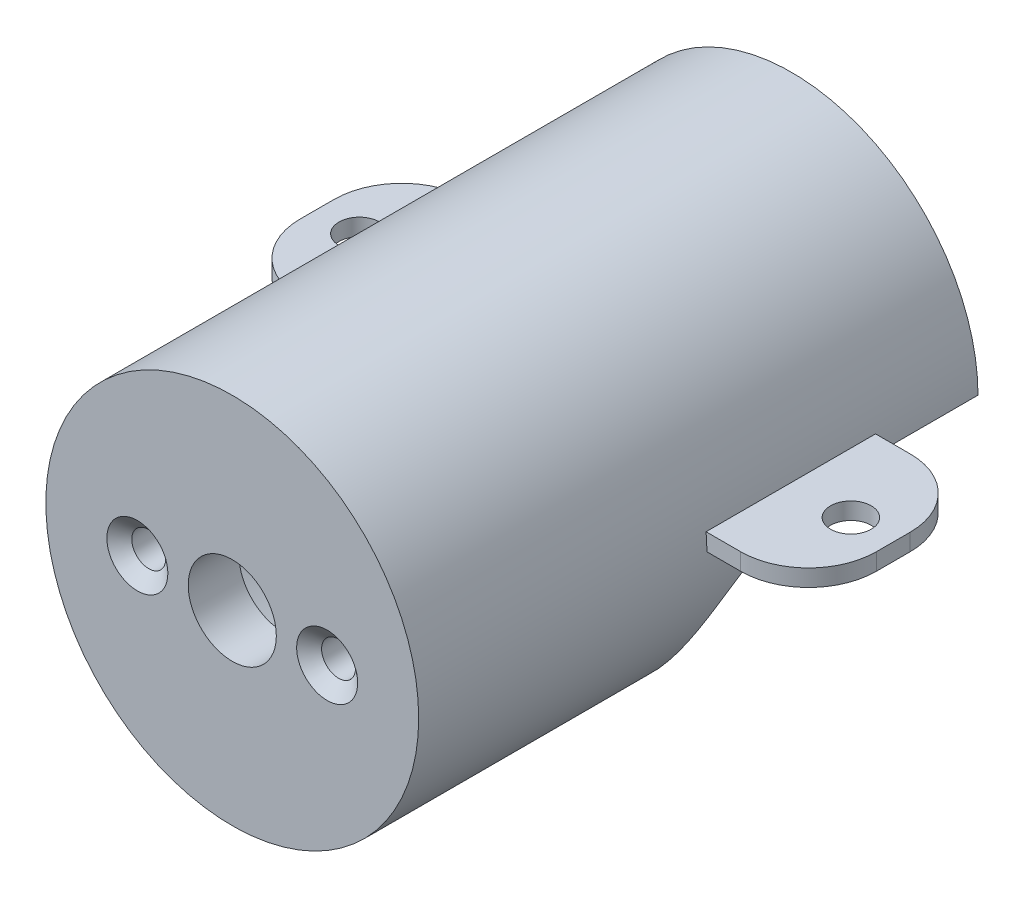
SolidWorks part; units mm, degrees
ref_plane "Front Plane" through (0, 0, 0) normal (0, 0, 1) x (1, 0, 0)
ref_plane "Top Plane" through (0, 0, 0) normal (0, 1, 0) x (1, 0, 0)
ref_plane "Right Plane" through (0, 0, 0) normal (1, 0, 0) x (0, 0, -1)
sketch "Sketch1" plane through (0, 0, 0) normal (0, 0, 1) x (1, 0, 0)
  circle A0 centre (0, 0) radius 12.7
  dimension "D1" = 25.4
extrude "Boss-Extrude1" add sketch "Sketch1" along normal blind 3.81
sketch "Sketch2" plane through (0, 0, 3.81) normal (0, 0, 1) x (1, 0, 0)
  line L0 (0, 12.7) -> (0, -12.7) construction
  line L1 (0, 0) -> (-12.065, 0) construction
  circle A0 centre (0, 0) radius 3.302
  circle A1 centre (0, 0) radius 12.7 construction
  circle A2 centre (0, 0) radius 12.065 construction
  circle A3 centre (-7.112, 0) radius 1.27
  circle A4 centre (7.112, 0) radius 1.27
  dimension "D1" = 24.13
  dimension "D2" = 2.54
  dimension "D4" = 6.604
  dimension "D3" = 4.953
extrude "Cut-Extrude1" cut sketch "Sketch2" against normal through all
hole_wizard "CSK for #0 Flat Head Machine Screw (100)1" positions "3DSketch1" profile "Sketch3" countersink size "#0" standard "ANSI Inch"
sketch3d "3DSketch1"
  line L0 (-7.112, 0, 0) -> (-7.112, 0, 3.81) construction
  line L1 (7.112, 0, 0) -> (7.112, 0, 3.81) construction
  point P0 (-7.112, 0, 3.81)
  point P4 (7.112, 0, 3.81)
  point P8 (15.2601, -5.7262, 0)
sketch "Sketch3" plane through (-7.112, 0, 3.81) normal (1, 0, 0) x (0, -1, 0)
  line L0 (0, 0) -> (0, 3.81)
  line L1 (0, 3.81) -> (1.27, 3.81)
  line L2 (1.27, 3.81) -> (1.27, 0.8525)
  line L3 (1.27, 0.8525) -> (2.286, 0)
  line L5 (2.286, 0) -> (0, 0)
  line L6 (-1.27, 0.8525) -> (-2.286, 0) construction
  line L11 (0, -6.35) -> (0, 107.95) construction
  dimension "Thru Hole Dia." = 2.54
  dimension "Thru Hole Depth" = 3.81
  dimension "Near C'Sink Dia." = 4.572
  dimension "Near C'Sink Angle" = 100
sketch "Sketch8" plane through (0, 0, 3.81) normal (0, 0, 1) x (1, 0, 0)
  circle A0 centre (0, 0) radius 12.7
  circle A1 centre (0, 0) radius 13.97
  dimension "D1" = 27.94
extrude "Boss-Extrude4" add sketch "Sketch8" against normal blind 41.91
sketch "Sketch9" plane through (0, 0, 0) normal (1, 0, 0) x (0, 0, -1)
  line L0 (38.1, -13.97) -> (38.1, 13.97) construction
  line L1 (40.5624, 0) -> (30.48, 0)
  line L2 (40.5624, 0) -> (40.5624, -15.3107)
  line L3 (40.5624, -15.3107) -> (30.48, -15.3107)
  line L4 (30.48, 0) -> (30.48, -15.3107)
  dimension "D1" = 13.97
  dimension "D2" = 7.62
extrude "Cut-Extrude2" cut sketch "Sketch9" against normal through all both and the other way through all
sketch "Sketch10" plane through (0, 0, 0) normal (0, 1, 0) x (1, 0, 0)
  line L0 (-13.97, 30.48) -> (-16.51, 30.48)
  line L1 (-21.59, 25.4) -> (-21.59, 22.86)
  line L2 (-16.51, 17.78) -> (-13.97, 17.78)
  line L3 (-13.97, 30.48) -> (-13.97, -3.81) construction
  line L5 (-13.97, 17.78) -> (-13.5311, 17.78)
  line L6 (-13.5311, 17.78) -> (-13.5311, 30.48)
  line L7 (-13.5311, 30.48) -> (-13.97, 30.48)
  line L8 (0, 0) -> (0, 39.7118) construction
  line L9 (21.59, 25.4) -> (21.59, 22.86)
  line L10 (13.97, 30.48) -> (16.51, 30.48)
  line L11 (13.5311, 30.48) -> (13.97, 30.48)
  line L12 (13.5311, 17.78) -> (13.5311, 30.48)
  line L13 (13.97, 17.78) -> (13.5311, 17.78)
  line L14 (16.51, 17.78) -> (13.97, 17.78)
  arc A0 (-21.59, 22.86) -> (-16.51, 17.78) centre (-16.51, 22.86) ccw
  arc A1 (-16.51, 30.48) -> (-21.59, 25.4) centre (-16.51, 25.4) ccw
  arc A2 (16.51, 30.48) -> (21.59, 25.4) centre (16.51, 25.4) cw
  arc A3 (21.59, 22.86) -> (16.51, 17.78) centre (16.51, 22.86) cw
  point P12 (-21.59, 17.78)
  point P15 (-21.59, 30.48)
  dimension "D3" = 5.08
  dimension "D1" = 7.62
  dimension "D2" = 12.7
extrude "Boss-Extrude5" add sketch "Sketch10" along normal blind 1.27
sketch "Sketch11" plane through (0, 0, 0) normal (1, 0, 0) x (0, 0, -1)
  line L0 (30.48, 0) -> (27.94, 0)
  line L1 (17.78, -10.16) -> (17.78, -15.0179)
  line L2 (17.78, -15.0179) -> (32.0548, -15.0179)
  line L3 (32.0548, -15.0179) -> (32.0548, 0)
  line L4 (38.1, 0) -> (30.48, 0) construction
  line L5 (32.0548, 0) -> (30.48, 0)
  arc A0 (27.94, 0) -> (17.78, -10.16) centre (27.94, -10.16) ccw
  point P11 (17.78, 0)
  dimension "D1" = 10.16
extrude "Cut-Extrude3" cut sketch "Sketch11" against normal through all both and the other way through all
sketch "Sketch12" plane through (0, 1.27, 0) normal (0, 1, 0) x (1, 0, 0)
  line L0 (21.59, 22.86) -> (21.59, 25.4) construction
  line L1 (0, 0) -> (0, 39.4322) construction
  circle A0 centre (18.415, 24.13) radius 1.524
  circle A1 centre (-18.415, 24.13) radius 1.524
  dimension "D1" = 3.048
  dimension "D2" = 3.175
extrude "Cut-Extrude4" cut sketch "Sketch12" against normal through all
